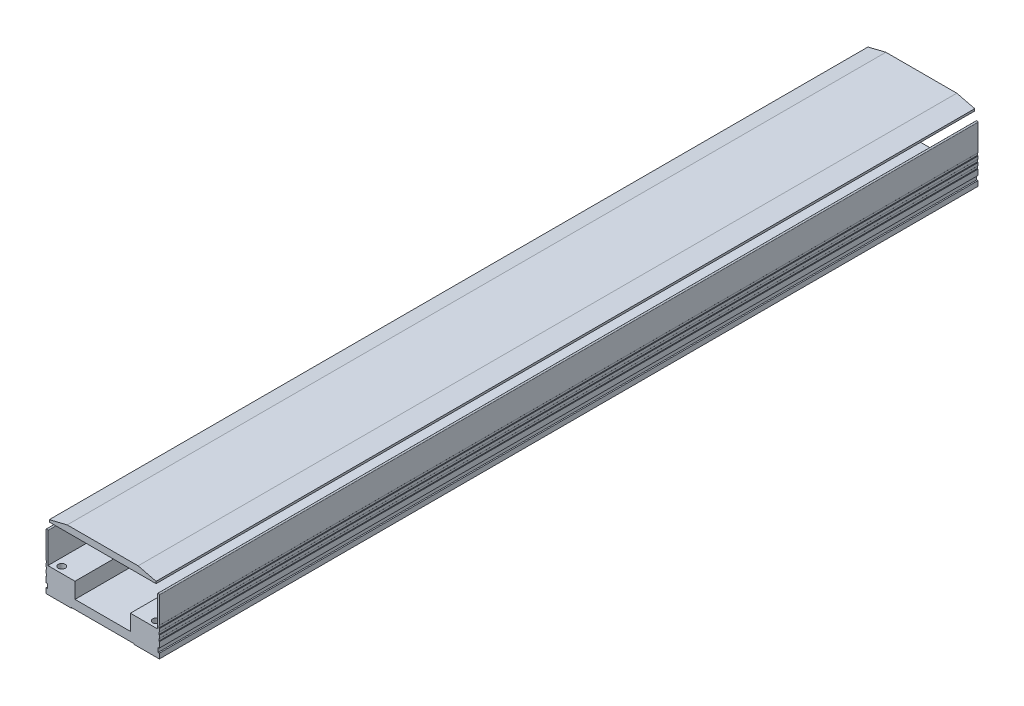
SolidWorks part; units mm, degrees
ref_plane "前视基准面" through (0, 0, 0) normal (0, 0, 1) x (1, 0, 0)
ref_plane "上视基准面" through (0, 0, 0) normal (0, 1, 0) x (1, 0, 0)
ref_plane "右视基准面" through (0, 0, 0) normal (1, 0, 0) x (0, 0, -1)
sketch "草图1" plane through (0, 0, 0) normal (0, 0, 1) x (1, 0, 0)
  line B0 (84.8, 100) -> (84.8, 103.28)
  line B1 (84.8, 103.28) -> (56.2812, 110.3)
  line B2 (56.2812, 110.3) -> (-56.2812, 110.3)
  line B3 (-56.2812, 110.3) -> (-84.8, 103.28)
  line B4 (-84.8, 103.28) -> (-84.8, 100)
  line B5 (-84.8, 100) -> (84.8, 100)
  line B6 (50, -1) -> (90, -1)
  line B7 (90, -1) -> (90, 7)
  line B8 (90, 7) -> (88, 7)
  line B9 (88, 7) -> (88, 14)
  line B10 (88, 14) -> (90, 14)
  line B11 (90, 14) -> (90, 22.7)
  line B12 (89.7, 23) -> (89.5, 23)
  line B13 (89.2, 23.3) -> (89.2, 26.7)
  line B14 (89.5, 27) -> (89.7, 27)
  line B15 (90, 27.3) -> (90, 31.7)
  line B16 (89.7, 32) -> (89.5, 32)
  line B17 (89.2, 32.3) -> (89.2, 35.7)
  line B18 (89.5, 36) -> (89.7, 36)
  line B19 (90, 36.3) -> (90, 40.7)
  line B20 (89.7, 41) -> (89.5, 41)
  line B21 (89.2, 41.3) -> (89.2, 44.7)
  line B22 (89.5, 45) -> (89.7, 45)
  line B23 (90, 45.3) -> (90, 87)
  line B24 (87, 87) -> (87, 39)
  line B25 (87, 39) -> (44, 39)
  line B26 (44, 39) -> (44, 14)
  line B27 (44, 14) -> (-44, 14)
  line B28 (-44, 14) -> (-44, 39)
  line B29 (-44, 39) -> (-87, 39)
  line B30 (-87, 39) -> (-87, 87)
  line B31 (-90, 87) -> (-90, 45.3)
  line B32 (-89.7, 45) -> (-89.5, 45)
  line B33 (-89.2, 44.7) -> (-89.2, 41.3)
  line B34 (-89.5, 41) -> (-89.7, 41)
  line B35 (-90, 40.7) -> (-90, 36.3)
  line B36 (-89.7, 36) -> (-89.5, 36)
  line B37 (-89.2, 35.7) -> (-89.2, 32.3)
  line B38 (-89.5, 32) -> (-89.7, 32)
  line B39 (-90, 31.7) -> (-90, 27.3)
  line B40 (-89.7, 27) -> (-89.5, 27)
  line B41 (-89.2, 26.7) -> (-89.2, 23.3)
  line B42 (-89.5, 23) -> (-89.7, 23)
  line B43 (-90, 22.7) -> (-90, 14)
  line B44 (-90, 14) -> (-88, 14)
  line B45 (-88, 14) -> (-88, 7)
  line B46 (-88, 7) -> (-90, 7)
  line B47 (-90, 7) -> (-90, -1)
  line B48 (-90, -1) -> (-50, -1)
  line B49 (-50, -1) -> (-50, 0)
  line B50 (-50, 0) -> (50, 0)
  line B51 (50, 0) -> (50, -1)
  arc B52 (90, 22.7) -> (89.7, 23) centre (89.7, 22.7) ccw
  arc B53 (89.2, 23.3) -> (89.5, 23) centre (89.5, 23.3) ccw
  arc B54 (89.5, 27) -> (89.2, 26.7) centre (89.5, 26.7) ccw
  arc B55 (89.7, 27) -> (90, 27.3) centre (89.7, 27.3) ccw
  arc B56 (90, 31.7) -> (89.7, 32) centre (89.7, 31.7) ccw
  arc B57 (89.2, 32.3) -> (89.5, 32) centre (89.5, 32.3) ccw
  arc B58 (89.5, 36) -> (89.2, 35.7) centre (89.5, 35.7) ccw
  arc B59 (89.7, 36) -> (90, 36.3) centre (89.7, 36.3) ccw
  arc B60 (90, 40.7) -> (89.7, 41) centre (89.7, 40.7) ccw
  arc B61 (89.2, 41.3) -> (89.5, 41) centre (89.5, 41.3) ccw
  arc B62 (89.5, 45) -> (89.2, 44.7) centre (89.5, 44.7) ccw
  arc B63 (89.7, 45) -> (90, 45.3) centre (89.7, 45.3) ccw
  arc B64 (90, 87) -> (87, 87) centre (88.5, 87) ccw
  arc B65 (-87, 87) -> (-90, 87) centre (-88.5, 87) ccw
  arc B66 (-90, 45.3) -> (-89.7, 45) centre (-89.7, 45.3) ccw
  arc B67 (-89.2, 44.7) -> (-89.5, 45) centre (-89.5, 44.7) ccw
  arc B68 (-89.5, 41) -> (-89.2, 41.3) centre (-89.5, 41.3) ccw
  arc B69 (-89.7, 41) -> (-90, 40.7) centre (-89.7, 40.7) ccw
  arc B70 (-90, 36.3) -> (-89.7, 36) centre (-89.7, 36.3) ccw
  arc B71 (-89.2, 35.7) -> (-89.5, 36) centre (-89.5, 35.7) ccw
  arc B72 (-89.5, 32) -> (-89.2, 32.3) centre (-89.5, 32.3) ccw
  arc B73 (-89.7, 32) -> (-90, 31.7) centre (-89.7, 31.7) ccw
  arc B74 (-90, 27.3) -> (-89.7, 27) centre (-89.7, 27.3) ccw
  arc B75 (-89.2, 26.7) -> (-89.5, 27) centre (-89.5, 26.7) ccw
  arc B76 (-89.5, 23) -> (-89.2, 23.3) centre (-89.5, 23.3) ccw
  arc B77 (-89.7, 23) -> (-90, 22.7) centre (-89.7, 22.7) ccw
sketch_block_instance "块1-1"
sketch_block "块1"
extrude "凸台-拉伸1" add sketch "草图1" along normal blind 1300
hole_wizard "打孔尺寸(%根据)内六角圆柱头螺钉的类型1" positions "草图2" profile "草图3" counterbore size "M6" standard "GB"
sketch "草图2" plane through (0, 39, 0) normal (0, 1, 0) x (1, 0, 0)
  line L0 (0, 0) -> (0, -99.2948) construction
  line L1 (-90, 0) -> (-50, 0) construction
  point P0 (-75, -90)
  point P7 (75, -90)
  dimension "D1" = 150
  dimension "D2" = 90
sketch "草图3" plane through (-75, 39, 90) normal (1, 0, 0) x (0, 0, 1)
  line L0 (0, 0) -> (0, 40)
  line L1 (0, 40) -> (3.3, 40)
  line L3 (3.3, 40) -> (3.3, 37.5)
  line L4 (3.3, 37.5) -> (5.5, 37.5)
  line L5 (5.5, 37.5) -> (5.5, 0)
  line L7 (5.5, 0) -> (0, 0)
  line L11 (0, -6.35) -> (0, 107.95) construction
  dimension "通孔孔直径" = 6.6
  dimension "通孔孔深度" = 40
  dimension "柱形沉头孔直径" = 11
  dimension "柱形沉头孔深度" = 37.5
hole_wizard "M8 螺纹孔1" positions "草图4" profile "草图5" tap size "M8" standard "GB"
sketch "草图4" plane through (0, -1, 0) normal (0, -1, 0) x (-1, 0, 0)
  line L0 (0, 0) -> (0, -97.4883) construction
  line L1 (50, 0) -> (-50, 0) construction
  point P0 (-65, -40)
  point P2 (65, -40)
  dimension "D1" = 130
  dimension "D2" = 40
sketch "草图5" plane through (65, -1, 40) normal (1, 0, 0) x (0, 0, -1)
  line L0 (0, 0) -> (0, 21.7929)
  line L1 (0, 21.7929) -> (3.4, 19.75)
  line L2 (3.4, 19.75) -> (3.4, 0)
  line L5 (3.4, 0) -> (0, 0)
  line L10 (0, 21.7929) -> (-3.4, 19.75) construction
  line L11 (0, -6.35) -> (0, 107.95) construction
  dimension "螺纹孔钻头直径" = 6.8
  dimension "螺纹孔钻头深度" = 19.75
  dimension "导头角度" = 118
pattern_linear "阵列(线性)1" count 13 spacing 100 along (0, 0, 1) of "打孔尺寸(%根据)内六角圆柱头螺钉的类型1", "M8 螺纹孔1"
